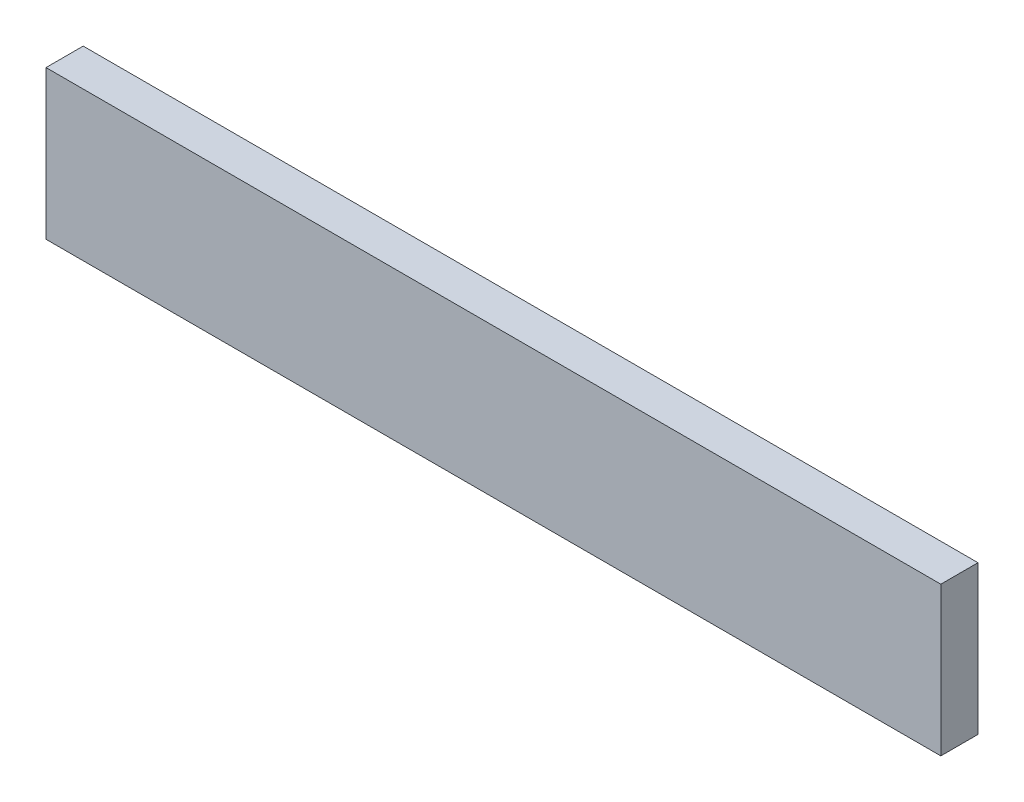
SolidWorks part; units mm, degrees
ref_plane "Plan de face" through (0, 0, 0) normal (0, 0, 1) x (1, 0, 0)
ref_plane "Plan de dessus" through (0, 0, 0) normal (0, 1, 0) x (1, 0, 0)
ref_plane "Plan de droite" through (0, 0, 0) normal (1, 0, 0) x (0, 0, -1)
sketch "Esquisse1" plane through (0, 0, 0) normal (0, 0, 1) x (1, 0, 0)
  line L1 (-180.5, 30) -> (180.5, 30)
  line L2 (-180.5, 30) -> (-180.5, -30)
  line L3 (-180.5, -30) -> (180.5, -30)
  line L4 (180.5, 30) -> (180.5, -30)
  line L5 (-180.5, 30) -> (180.5, -30) construction
  line L6 (-180.5, -30) -> (180.5, 30) construction
  point P0 (0, 0)
  dimension "D1" = 361
  dimension "D2" = 60
extrude "Boss.-Extru.1" add sketch "Esquisse1" along normal blind 15
